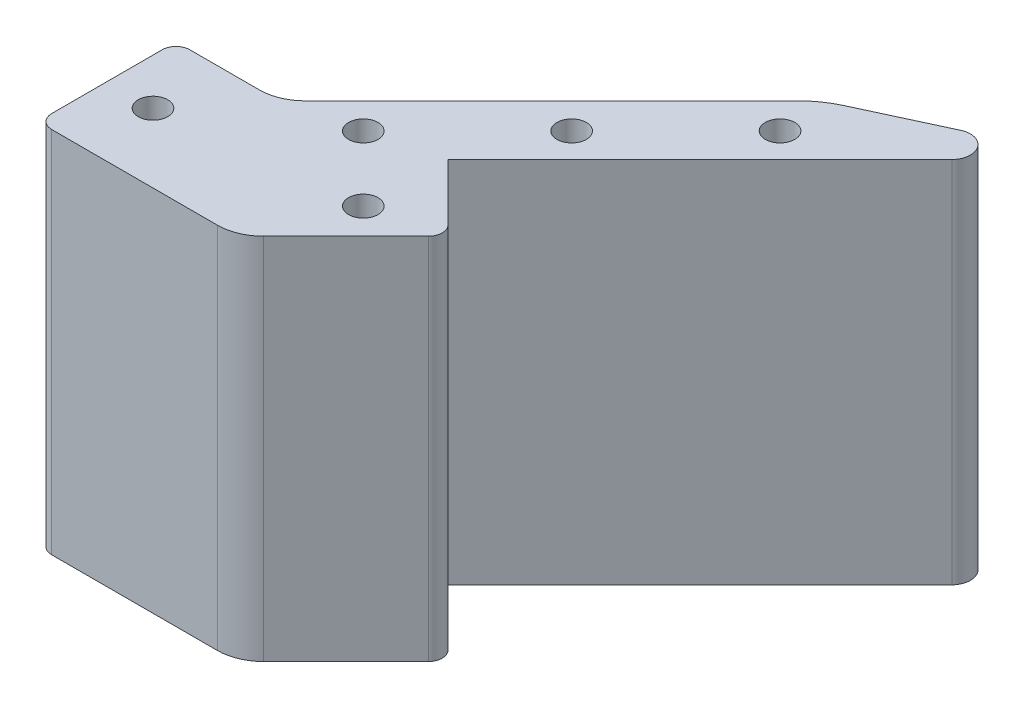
SolidWorks part; units mm, degrees
ref_plane "前视基准面" through (0, 0, 0) normal (0, 0, 1) x (1, 0, 0)
ref_plane "上视基准面" through (0, 0, 0) normal (0, 1, 0) x (1, 0, 0)
ref_plane "右视基准面" through (0, 0, 0) normal (1, 0, 0) x (0, 0, -1)
other "Configuration Table"
sketch "草图1" plane through (0, 0, 0) normal (0, 1, 0) x (1, 0, 0)
  line L0 (215.6676, 208.5965) -> (-208.5965, -215.6676) construction
  line L1 (0, 0) -> (-250, 0) construction
  line L2 (0, 0) -> (0, -250) construction
  line L3 (0, -250) -> (-250, -250) construction
  line L4 (-250, 0) -> (-250, -250) construction
  line L5 (215.6676, 208.5965) -> (208.5965, 215.6676) construction
  line L6 (-208.5965, -215.6676) -> (-215.6676, -208.5965) construction
  line L7 (208.5965, 215.6676) -> (-215.6676, -208.5965) construction
  line L8 (215.6676, 208.5965) -> (-215.6676, -208.5965) construction
  line L9 (-208.5965, -215.6676) -> (208.5965, 215.6676) construction
  line L10 (-208.5965, -208.5965) -> (-194.4544, -194.4544) construction
  line L11 (-173.2412, -180.3122) -> (-180.3122, -173.2412) construction
  line L12 (-180.3122, -173.2412) -> (-239.1009, -200.4628) construction
  line L13 (-242, -205) -> (-242, -235) construction
  line L14 (-237, -240) -> (-232.9289, -240) construction
  line L15 (-232.9289, -240) -> (-173.2412, -180.3122) construction
  line L16 (-200.8183, -188.0904) -> (-212.132, -199.4041) construction
  line L17 (-223.4457, -210.7178) -> (-216.3747, -217.7889) construction
  line L18 (-202.6389, -184.2541) -> (-230.8848, -212.5)
  line L19 (-230.8848, -212.5) -> (-242, -212.5)
  line L20 (-242, -212.5) -> (-242, -227.5)
  line L21 (-242, -227.5) -> (-220.4289, -227.5)
  line L22 (-220.4289, -227.5) -> (-208.9501, -216.0211)
  line L23 (-208.9501, -216.0211) -> (-216.1625, -208.8086)
  line L24 (-216.1625, -208.8086) -> (-188.7969, -181.443)
  line L25 (-191.0515, -178.2139) -> (-199.7696, -182.2508)
  circle A0 centre (-208.5965, -208.5965) radius 2.1 construction
  circle A1 centre (-194.4544, -194.4544) radius 2.1 construction
  circle A2 centre (-180.3122, -180.3122) radius 2.1 construction
  circle A3 centre (-237, -235) radius 2.1 construction
  circle A4 centre (-237, -220) radius 1.6
  circle A5 centre (-237, -205) radius 2.1 construction
  arc A6 (-242, -235) -> (-237, -240) centre (-237, -235) ccw construction
  arc A7 (-239.1009, -200.4628) -> (-242, -205) centre (-237, -205) ccw construction
  circle A8 centre (-200.8183, -188.0904) radius 1.6
  circle A9 centre (-212.132, -199.4041) radius 1.6
  circle A10 centre (-223.4457, -210.7178) radius 1.6
  circle A11 centre (-216.3747, -217.7889) radius 1.6
  arc A12 (-188.7969, -181.443) -> (-191.0515, -178.2139) centre (-190.2111, -180.0288) ccw
  arc A13 (-199.7696, -182.2508) -> (-202.6389, -184.2541) centre (-195.5678, -191.3251) ccw
  point P52 (-225.6345, -206.4682)
  point P53 (0, 0)
  point P54 (-197.2908, -186.7105)
  point P55 (-199.6776, -185.3844)
  point P56 (-204.3518, -187.0751)
  point P57 (0, 0)
  point P58 (-195.5513, -184.8632)
  point P59 (-230.7658, -208.2053)
  point P60 (0, 0)
  dimension "D8" = 4.2
  dimension "D13" = 4.2
  dimension "D16" = 5
  dimension "D17" = 3.2
  dimension "D23" = 3.2
  dimension "D27" = 4
  dimension "D28" = 2
  dimension "D31" = 10
  dimension "D1" = 250
  dimension "D2" = 250
  dimension "D3" = 45
  dimension "D4" = 600
  dimension "D5" = 10
  dimension "D7" = 20
  dimension "D9" = 5
  dimension "D10" = 5
  dimension "D11" = 10
  dimension "D12" = 8
  dimension "D14" = 30
  dimension "D15" = 15
  dimension "D18" = 5
  dimension "D20" = 16
  dimension "D21" = 4
  dimension "D22" = 25
  dimension "D24" = 10
  dimension "D25" = 0.5
  dimension "D26" = 0.2
  dimension "D29" = 7.5
  dimension "D30" = 7.5
  dimension "D6" = 3
  dimension "D19" = 3
extrude "凸台-拉伸1" add sketch "草图1" along normal blind 40
fillet "圆角3" radius 1.5 3 edges at (-208.9501, 20, 216.0211) (-242, 20, 212.5) (-242, 20, 227.5)
fillet "圆角4" radius 5 2 edges at (-230.8848, 20, 212.5) (-220.4289, 20, 227.5)
